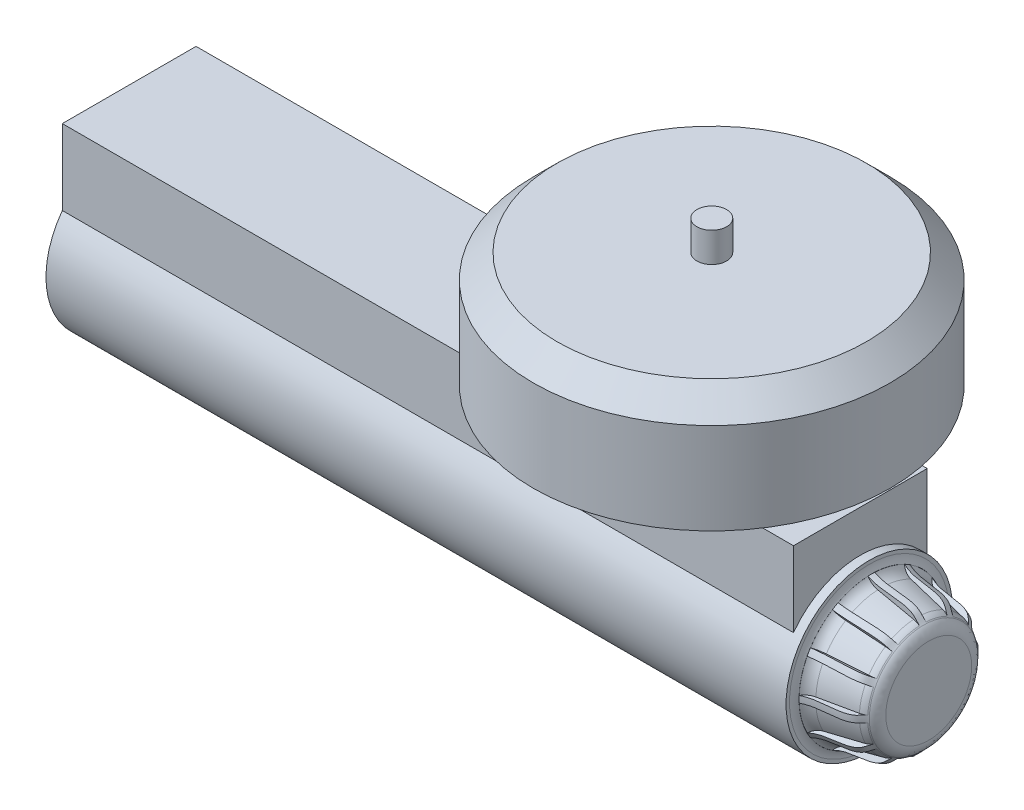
SolidWorks part; units mm, degrees
ref_plane "前视基准面" through (0, 0, 0) normal (0, 0, 1) x (1, 0, 0)
ref_plane "上视基准面" through (0, 0, 0) normal (0, 1, 0) x (1, 0, 0)
ref_plane "右视基准面" through (0, 0, 0) normal (1, 0, 0) x (0, 0, -1)
sketch "草图1" plane through (0, 0, 0) normal (0, 1, 0) x (1, 0, 0)
  circle A0 centre (0, 0) radius 60.05
  dimension "D1" = 120.1
extrude "凸台-拉伸1" add sketch "草图1" along normal blind 49.2
sketch "草图2" plane through (0, 0, 0) normal (0, -1, 0) x (1, 0, 0)
  line L0 (0, 0) -> (60.05, 0) construction
  line L1 (-196, 22.5) -> (50, 22.5)
  line L2 (-196, 22.5) -> (-196, -22.5)
  line L3 (-196, -22.5) -> (50, -22.5)
  line L4 (50, 22.5) -> (50, -22.5)
  line L5 (-196, 22.5) -> (50, -22.5) construction
  line L6 (-196, -22.5) -> (50, 22.5) construction
  circle A0 centre (0, 0) radius 60.05 construction
  point P0 (-73, 0)
  dimension "D1" = 45
  dimension "D2" = 50
  dimension "D3" = 246
extrude "凸台-拉伸2" add sketch "草图2" along normal blind 42
sketch "草图3" plane through (50, 0, 0) normal (1, 0, 0) x (0, 0, -1)
  line L0 (22.5, -42) -> (-22.5, -42) construction
  circle A0 centre (0, -42) radius 25
  circle A1 centre (0, -42) radius 28
  dimension "D1" = 50
  dimension "D2" = 3
extrude "凸台-拉伸3" add sketch "草图3" against normal up to surface (246 mm away)
sketch "草图4" plane through (50, 0, 0) normal (1, 0, 0) x (0, 0, -1)
  line L0 (22.5, -42) -> (-22.5, -42) construction
  circle A0 centre (0, -42) radius 25
  arc A1 (-22.5, -31.1028) -> (22.5, -31.1028) centre (0, -42) ccw construction
extrude "切除-拉伸1" cut sketch "草图4" against normal through all
sketch "草图5" plane through (0, 49.2, 0) normal (0, 1, 0) x (1, 0, 0)
  circle A0 centre (0, 0) radius 5
  dimension "D1" = 10
extrude "凸台-拉伸4" add sketch "草图5" along normal blind 10
sketch "草图6" plane through (50, 0, 0) normal (1, 0, 0) x (0, 0, -1)
  circle A0 centre (0, -42) radius 28
  arc A1 (-22.5, -25.3342) -> (22.5, -25.3342) centre (0, -42) ccw construction
extrude "凸台-拉伸5" add sketch "草图6" along normal blind 3
sketch "草图7" plane through (53, 0, 0) normal (1, 0, 0) x (0, 0, -1)
  circle A0 centre (0, -42) radius 22.7946
extrude "凸台-拉伸6" add sketch "草图7" along normal blind 20 draft 12
fillet "圆角1" radius 5 1 edges at (73, -42, -18.5434)
fillet "圆角2" radius 5 1 edges at (53, -42, -22.7946)
sketch "草图8" plane through (73, 0, 0) normal (1, 0, 0) x (0, 0, -1)
  line L0 (11.2015, -20.3869) -> (13.1168, -21.4927)
  line L1 (-1.1058, -17.6818) -> (1.1058, -17.6818)
  line L2 (-1.1058, -17.6818) -> (-1.1058, -27.5477)
  line L3 (-1.1058, -27.5477) -> (1.1058, -27.5477)
  line L4 (1.1058, -17.6818) -> (1.1058, -27.5477)
  line L5 (-1.1058, -17.6818) -> (1.1058, -27.5477) construction
  line L6 (-1.1058, -27.5477) -> (1.1058, -17.6818) construction
  line L7 (11.2015, -20.3869) -> (6.2685, -28.9311)
  line L8 (6.2685, -28.9311) -> (8.1838, -30.0369)
  line L9 (13.1168, -21.4927) -> (8.1838, -30.0369)
  line L10 (11.2015, -20.3869) -> (8.1838, -30.0369) construction
  line L11 (6.2685, -28.9311) -> (13.1168, -21.4927) construction
  line L12 (20.5073, -28.8832) -> (21.6131, -30.7985)
  line L13 (20.5073, -28.8832) -> (11.9631, -33.8162)
  line L14 (11.9631, -33.8162) -> (13.0689, -35.7315)
  line L15 (21.6131, -30.7985) -> (13.0689, -35.7315)
  line L16 (20.5073, -28.8832) -> (13.0689, -35.7315) construction
  line L17 (11.9631, -33.8162) -> (21.6131, -30.7985) construction
  line L18 (24.3182, -40.8942) -> (24.3182, -43.1058)
  line L19 (24.3182, -40.8942) -> (14.4523, -40.8942)
  line L20 (14.4523, -40.8942) -> (14.4523, -43.1058)
  line L21 (24.3182, -43.1058) -> (14.4523, -43.1058)
  line L22 (24.3182, -40.8942) -> (14.4523, -43.1058) construction
  line L23 (14.4523, -40.8942) -> (24.3182, -43.1058) construction
  line L24 (21.6131, -53.2015) -> (20.5073, -55.1168)
  line L25 (21.6131, -53.2015) -> (13.0689, -48.2685)
  line L26 (13.0689, -48.2685) -> (11.9631, -50.1838)
  line L27 (20.5073, -55.1168) -> (11.9631, -50.1838)
  line L28 (21.6131, -53.2015) -> (11.9631, -50.1838) construction
  line L29 (13.0689, -48.2685) -> (20.5073, -55.1168) construction
  line L30 (13.1168, -62.5073) -> (11.2015, -63.6131)
  line L31 (13.1168, -62.5073) -> (8.1838, -53.9631)
  line L32 (8.1838, -53.9631) -> (6.2685, -55.0689)
  line L33 (11.2015, -63.6131) -> (6.2685, -55.0689)
  line L34 (13.1168, -62.5073) -> (6.2685, -55.0689) construction
  line L35 (8.1838, -53.9631) -> (11.2015, -63.6131) construction
  line L36 (1.1058, -66.3182) -> (-1.1058, -66.3182)
  line L37 (1.1058, -66.3182) -> (1.1058, -56.4523)
  line L38 (1.1058, -56.4523) -> (-1.1058, -56.4523)
  line L39 (-1.1058, -66.3182) -> (-1.1058, -56.4523)
  line L40 (1.1058, -66.3182) -> (-1.1058, -56.4523) construction
  line L41 (1.1058, -56.4523) -> (-1.1058, -66.3182) construction
  line L42 (-11.2015, -63.6131) -> (-13.1168, -62.5073)
  line L43 (-11.2015, -63.6131) -> (-6.2685, -55.0689)
  line L44 (-6.2685, -55.0689) -> (-8.1838, -53.9631)
  line L45 (-13.1168, -62.5073) -> (-8.1838, -53.9631)
  line L46 (-11.2015, -63.6131) -> (-8.1838, -53.9631) construction
  line L47 (-6.2685, -55.0689) -> (-13.1168, -62.5073) construction
  line L48 (-20.5073, -55.1168) -> (-21.6131, -53.2015)
  line L49 (-20.5073, -55.1168) -> (-11.9631, -50.1838)
  line L50 (-11.9631, -50.1838) -> (-13.0689, -48.2685)
  line L51 (-21.6131, -53.2015) -> (-13.0689, -48.2685)
  line L52 (-20.5073, -55.1168) -> (-13.0689, -48.2685) construction
  line L53 (-11.9631, -50.1838) -> (-21.6131, -53.2015) construction
  line L54 (-24.3182, -43.1058) -> (-24.3182, -40.8942)
  line L55 (-24.3182, -43.1058) -> (-14.4523, -43.1058)
  line L56 (-14.4523, -43.1058) -> (-14.4523, -40.8942)
  line L57 (-24.3182, -40.8942) -> (-14.4523, -40.8942)
  line L58 (-24.3182, -43.1058) -> (-14.4523, -40.8942) construction
  line L59 (-14.4523, -43.1058) -> (-24.3182, -40.8942) construction
  line L60 (-21.6131, -30.7985) -> (-20.5073, -28.8832)
  line L61 (-21.6131, -30.7985) -> (-13.0689, -35.7315)
  line L62 (-13.0689, -35.7315) -> (-11.9631, -33.8162)
  line L63 (-20.5073, -28.8832) -> (-11.9631, -33.8162)
  line L64 (-21.6131, -30.7985) -> (-11.9631, -33.8162) construction
  line L65 (-13.0689, -35.7315) -> (-20.5073, -28.8832) construction
  line L66 (-13.1168, -21.4927) -> (-11.2015, -20.3869)
  line L67 (-13.1168, -21.4927) -> (-8.1838, -30.0369)
  line L68 (-8.1838, -30.0369) -> (-6.2685, -28.9311)
  line L69 (-11.2015, -20.3869) -> (-6.2685, -28.9311)
  line L70 (-13.1168, -21.4927) -> (-6.2685, -28.9311) construction
  line L71 (-8.1838, -30.0369) -> (-11.2015, -20.3869) construction
  circle A0 centre (0, -42) radius 19.3852 construction
  circle A1 centre (0, -42) radius 14.4945 construction
  point P0 (0, -22.6148)
  point P12 (9.6926, -25.2119)
  point P17 (16.7881, -32.3074)
  point P22 (19.3852, -42)
  point P27 (16.7881, -51.6926)
  point P32 (9.6926, -58.7881)
  point P37 (0, -61.3852)
  point P42 (-9.6926, -58.7881)
  point P47 (-16.7881, -51.6926)
  point P52 (-19.3852, -42)
  point P57 (-16.7881, -32.3074)
  point P62 (-9.6926, -25.2119)
  point P67 (0, -42)
  dimension "D1" = 12
extrude "凸台-拉伸7" add sketch "草图8" against normal up to surface (20 mm away)
sketch "草图9" plane through (73, 0, 0) normal (1, 0, 0) x (0, 0, -1)
  point P0 (0, -42)
ref_plane "基准面1" through (0, -42, 0) normal (0, 1, 0) x (1, 0, 0)
sketch "草图10" plane through (0, -42, 0) normal (0, 1, 0) x (1, 0, 0)
  line L0 (73, 0) -> (-196, 0) construction
  line L1 (-196, -22.5) -> (-196, 22.5) construction
sketch "草图11" plane through (0, -42, 0) normal (0, 1, 0) x (1, 0, 0)
  line L0 (53.6699, 24.3182) -> (73, 34.2107)
  line L2 (73, 14.4523) -> (73, 24.3182)
  line L3 (73, 24.3182) -> (53.6699, 24.3182)
  line L4 (73, 14.4523) -> (73, 34.2107)
  spline S0 degree 3 poles (53.6699, 24.3182) (58.7118, 21.7715) (67.3485, 23.6183) (70.34, 19.0448) (71.2596, 18.2532) knots 0 0 0 0 0.791781 1 1 1 1
  spline S4 degree 3 poles (3870.446, -1211.1242) (-39.209, -126.8131) (47.4763, 28.0615) (70.1201, 18.9996) (70.3746, 18.8716) (71.1061, 18.4211) (71.5301, 18.0476) (72.2491, 17.1557) (72.5241, 16.6622) (94.7466, -46.3941) (-1158.5276, -335.7674) (-3628.8613, 1311.1722) knots -10.42886 -10.42886 -10.42886 -10.42886 0.125 0.125 0.25 0.25 0.5 0.5 0.75 0.75 29.686271 29.686271 29.686271 29.686271 only from (69.0396, 19.3537) to (73, 14.4523)
  spline S5 degree 3 poles (-915.0524, 256.8527) (-271.1125, 61.6977) (397.3486, -18.4322) (1039.6293, -221.3818) knots -0.985096 -0.985096 -0.985096 -0.985096 1.026337 1.026337 1.026337 1.026337 only from (56.9604, 21.9249) to (69.0396, 19.3537)
  spline S6 degree 3 poles (920.0913, -474.9941) (139.7963, 149.3117) (39.3978, 39.9929) (54.5227, 23.2072) (54.7828, 22.9737) (55.2041, 22.6676) (55.3501, 22.5728) (55.6532, 22.3977) (55.8107, 22.3175) (85.883, 8.9416) (215.1133, 299.7497) (457.8296, 938.0563) knots -15.56724 -15.56724 -15.56724 -15.56724 0.25 0.25 0.5 0.5 0.625 0.625 0.75 0.75 24.204968 24.204968 24.204968 24.204968 only from (53.6699, 24.3182) to (56.9604, 21.9249)
  spline S7 degree 3 poles (71.2596, 18.2532) (71.4878, 18.0567) (71.6979, 17.8394) (72.2491, 17.1557) (72.5241, 16.6622) (72.9048, 15.5819) (73, 15.0249) (73, 14.4523) knots 0.366686 0.366686 0.366686 0.366686 0.5 0.5 0.75 0.75 1 1 1 1
  dimension "D1" = 0
revolve "切除-旋转6" cut sketch "草图11" angle 360 about L0
chamfer "倒角1" distance 8 angle 45 1 edges at (0, 49.2, 60.05)
sketch "草图12" plane through (0, 0, 0) normal (0, -1, 0) x (1, 0, 0)
  circle A0 centre (0, 0) radius 60.05
  circle A1 centre (0, 0) radius 26.9476
extrude "切除-拉伸3" cut sketch "草图12" against normal blind 0.5
chamfer "倒角2" distance 10 angle 68 1 edges at (0, 0.5, -60.05)
